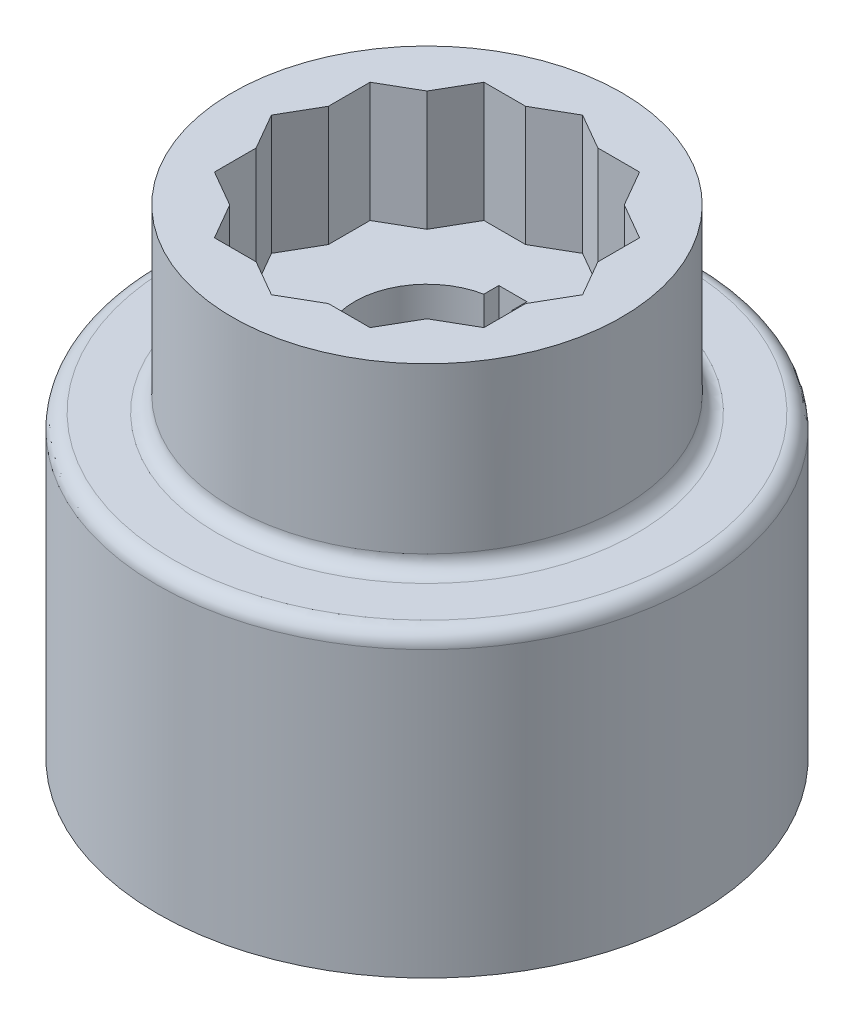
SolidWorks part; units mm, degrees
ref_plane "Front Plane" through (0, 0, 0) normal (0, 0, 1) x (1, 0, 0)
ref_plane "Top Plane" through (0, 0, 0) normal (0, 1, 0) x (1, 0, 0)
ref_plane "Right Plane" through (0, 0, 0) normal (1, 0, 0) x (0, 0, -1)
sketch "Sketch1"
  dimension "D1" = 114.3
extrude "Extrude1" add sketch "Sketch1" along normal blind 63.5
sketch "Sketch2"
  dimension "D1" = 82.55
extrude "Extrude2" add sketch "Sketch2" along normal blind 38.1
fillet "Fillet1" radius 3.175 2 edges at (0, 63.5, 57.15) (0, 63.5, 41.275)
sketch "Sketch6"
  dimension "D1" = 57.15
extrude "HexCut1" cut sketch "Sketch6" against normal blind 25.4
sketch "Sketch7"
extrude "HexCut2" cut sketch "Sketch7" against normal blind 25.4
sketch "Sketch8"
extrude "Keyway" cut sketch "Sketch8" against normal blind 38.1
sketch "Sketch9"
extrude "Hole" cut sketch "Sketch9" against normal through all
other "Standard Cutout<1>"
